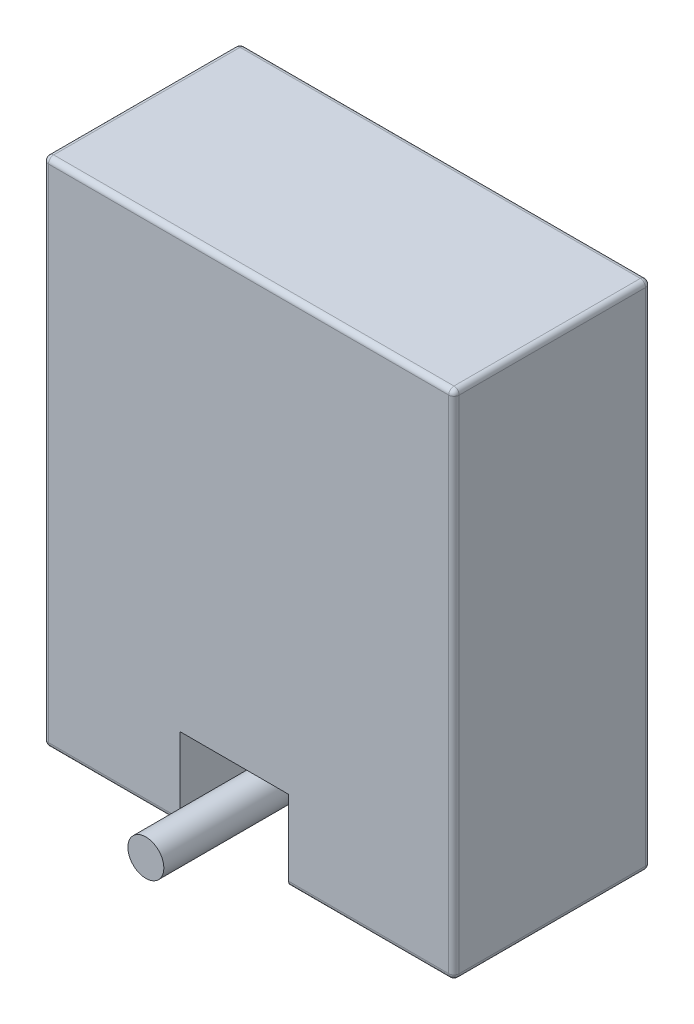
SolidWorks part; units mm, degrees
ref_plane "Front" through (0, 0, 0) normal (0, 0, 1) x (1, 0, 0)
ref_plane "Top" through (0, 0, 0) normal (0, 1, 0) x (1, 0, 0)
ref_plane "Right" through (0, 0, 0) normal (1, 0, 0) x (0, 0, -1)
sketch "Sketch1" plane through (0, 0, 0) normal (0, 0, 1) x (1, 0, 0)
  line L1 (0, 0) -> (29.8196, 0)
  line L2 (0, 0) -> (0, 37.1348)
  line L3 (0, 37.1348) -> (29.8196, 37.1348)
  line L4 (29.8196, 0) -> (29.8196, 37.1348)
  dimension "D1" = 29.8196
  dimension "D2" = 37.1348
extrude "Boss-Extrude1" add sketch "Sketch1" against normal blind 14.2875
fillet "Fillet1" radius 0.381 12 edges at (14.9098, 0, -14.2875) (29.8196, 18.5674, -14.2875) (14.9098, 37.1348, -14.2875) (0, 18.5674, -14.2875) (14.9098, 37.1348, 0) (29.8196, 18.5674, 0) (14.9098, 0, 0) (0, 18.5674, 0) (0, 37.1348, -7.1437) (0, 0, -7.1437) (29.8196, 0, -7.1437) (29.8196, 37.1348, -7.1437)
sketch "Sketch2" plane through (0, 0, 0) normal (0, 0, 1) x (1, 0, 0)
  line L0 (29.4386, 0) -> (0.381, 0) construction
  line L1 (9.9221, 5.8424) -> (17.8086, 5.8424)
  line L2 (9.9221, 5.8424) -> (9.9221, 0)
  line L3 (9.9221, 0) -> (17.8086, 0)
  line L4 (17.8086, 5.8424) -> (17.8086, 0)
extrude "Cut-Extrude1" cut sketch "Sketch2" against normal blind 6.35
sketch "Sketch3" plane through (0, 0, -6.35) normal (0, 0, 1) x (1, 0, 0)
  circle A0 centre (13.8014, 3.0288) radius 1.3049
extrude "Boss-Extrude2" add sketch "Sketch3" along normal blind 12.7
